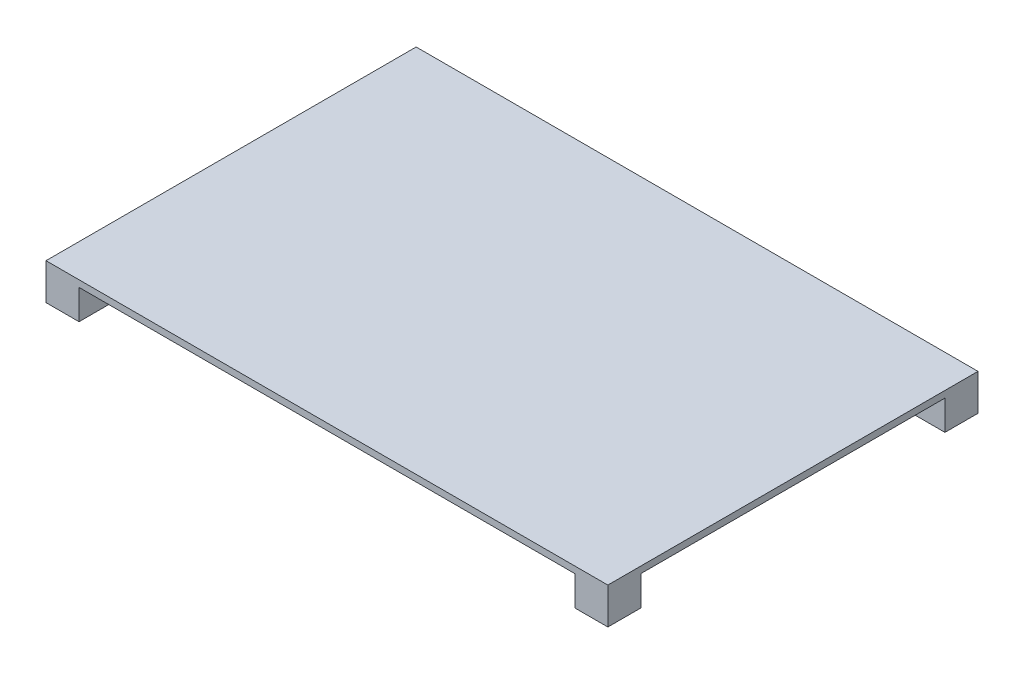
SolidWorks part; units mm, degrees
ref_plane "Front Plane" through (0, 0, 0) normal (0, 0, 1) x (1, 0, 0)
ref_plane "Top Plane" through (0, 0, 0) normal (0, 1, 0) x (1, 0, 0)
ref_plane "Right Plane" through (0, 0, 0) normal (1, 0, 0) x (0, 0, -1)
sketch "Sketch1" plane through (0, 0, 0) normal (0, 1, 0) x (1, 0, 0)
  line L1 (42.5, -28) -> (-42.5, -28)
  line L2 (42.5, -28) -> (42.5, 28)
  line L3 (42.5, 28) -> (-42.5, 28)
  line L4 (-42.5, -28) -> (-42.5, 28)
  line L5 (42.5, -28) -> (-42.5, 28) construction
  line L6 (42.5, 28) -> (-42.5, -28) construction
  point P0 (0, 0)
  dimension "D1" = 85
  dimension "D2" = 56
extrude "Boss-Extrude1" add sketch "Sketch1" along normal blind 1
sketch "Sketch2" plane through (0, 0, 0) normal (0, -1, 0) x (1, 0, 0)
  line L1 (-42.5, 28) -> (-37.5, 28)
  line L2 (-42.5, 28) -> (-42.5, 23)
  line L3 (-42.5, 23) -> (-37.5, 23)
  line L4 (-37.5, 28) -> (-37.5, 23)
  line L5 (-42.5, -28) -> (-37.5, -28)
  line L6 (-42.5, -28) -> (-42.5, -23)
  line L7 (-42.5, -23) -> (-37.5, -23)
  line L8 (-37.5, -28) -> (-37.5, -23)
  line L9 (42.5, -28) -> (37.5, -28)
  line L10 (42.5, -28) -> (42.5, -23)
  line L11 (42.5, -23) -> (37.5, -23)
  line L12 (37.5, -28) -> (37.5, -23)
  line L13 (42.5, 28) -> (37.5, 28)
  line L14 (42.5, 28) -> (42.5, 23)
  line L15 (42.5, 23) -> (37.5, 23)
  line L16 (37.5, 28) -> (37.5, 23)
  dimension "D1" = 5
extrude "Boss-Extrude2" add sketch "Sketch2" along normal blind 4.5
